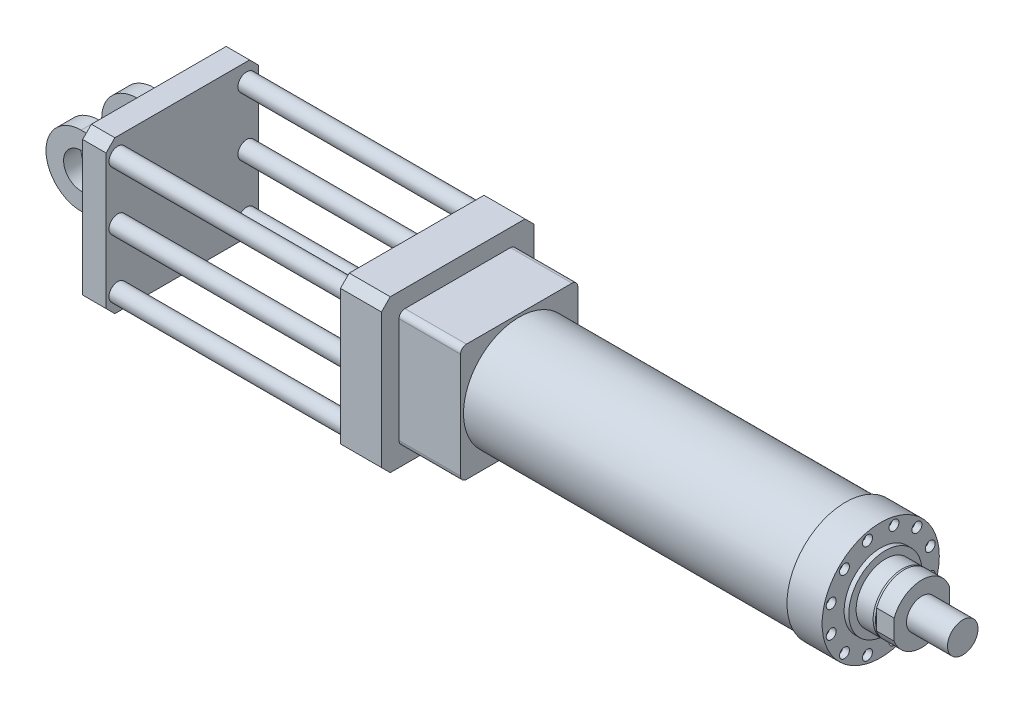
SolidWorks part; units mm, degrees
ref_plane "前视基准面" through (0, 0, 0) normal (0, 0, 1) x (1, 0, 0)
ref_plane "上视基准面" through (0, 0, 0) normal (0, 1, 0) x (1, 0, 0)
ref_plane "右视基准面" through (0, 0, 0) normal (1, 0, 0) x (0, 0, -1)
sketch "草图1" plane through (0, 0, 0) normal (1, 0, 0) x (0, 0, -1)
  circle A0 centre (0, 0) radius 80
  circle A1 centre (0, 0) radius 95
  dimension "D1" = 190
  dimension "D2" = 160
extrude "凸台-拉伸1" add sketch "草图1" along normal blind 557
sketch "草图2" plane through (557, 0, 0) normal (1, 0, 0) x (0, 0, -1)
  circle A0 centre (0, 0) radius 100
  dimension "D1" = 200
extrude "凸台-拉伸2" add sketch "草图2" along normal blind 60
sketch "草图3" plane through (617, 0, 0) normal (1, 0, 0) x (0, 0, -1)
  circle A0 centre (0, 0) radius 62.5
  dimension "D1" = 125
extrude "凸台-拉伸3" add sketch "草图3" along normal blind 8
sketch "草图4" plane through (617, 0, 0) normal (1, 0, 0) x (0, 0, -1)
  line L0 (0, 0) -> (0, 177.9426) construction
  line L1 (0, 0) -> (-182.6844, 0) construction
  line L2 (0, 0) -> (-40.3471, 150.5773) construction
  line L3 (0, 0) -> (-50.7607, 156.2254) construction
  circle A0 centre (0, 0) radius 87.5 construction
  circle A1 centre (-22.6467, 84.5185) radius 5.5
  circle A2 centre (-22.6467, 84.5185) radius 8.5
  circle A3 centre (0, 0) radius 112.5 construction
  circle A4 centre (-34.7644, 106.9939) radius 9
  circle A5 centre (34.7644, 106.9939) radius 9
  circle A6 centre (91.0144, 66.1258) radius 9
  circle A7 centre (112.5, 0) radius 9
  circle A8 centre (91.0144, -66.1258) radius 9
  circle A9 centre (34.7644, -106.9939) radius 9
  circle A10 centre (-34.7644, -106.9939) radius 9
  circle A11 centre (-91.0144, -66.1258) radius 9
  circle A12 centre (-112.5, 0) radius 9
  circle A13 centre (-91.0144, 66.1258) radius 9
  circle A14 centre (22.6467, 84.5185) radius 8.5
  circle A15 centre (22.6467, 84.5185) radius 5.5
  circle A16 centre (61.8718, 61.8718) radius 8.5
  circle A17 centre (61.8718, 61.8718) radius 5.5
  circle A18 centre (84.5185, 22.6467) radius 8.5
  circle A19 centre (84.5185, 22.6467) radius 5.5
  circle A20 centre (84.5185, -22.6467) radius 8.5
  circle A21 centre (84.5185, -22.6467) radius 5.5
  circle A22 centre (61.8718, -61.8718) radius 8.5
  circle A23 centre (61.8718, -61.8718) radius 5.5
  circle A24 centre (22.6467, -84.5185) radius 8.5
  circle A25 centre (22.6467, -84.5185) radius 5.5
  circle A26 centre (-22.6467, -84.5185) radius 8.5
  circle A27 centre (-22.6467, -84.5185) radius 5.5
  circle A28 centre (-61.8718, -61.8718) radius 8.5
  circle A29 centre (-61.8718, -61.8718) radius 5.5
  circle A30 centre (-84.5185, -22.6467) radius 8.5
  circle A31 centre (-84.5185, -22.6467) radius 5.5
  circle A32 centre (-84.5185, 22.6467) radius 8.5
  circle A33 centre (-84.5185, 22.6467) radius 5.5
  circle A34 centre (-61.8718, 61.8718) radius 8.5
  circle A35 centre (-61.8718, 61.8718) radius 5.5
  point P33 (0, 0)
  point P67 (0, 0)
  dimension "D1" = 175
  dimension "D3" = 11
  dimension "D4" = 17
  dimension "D5" = 225
  dimension "D7" = 18
  dimension "D2" = 15
  dimension "D6" = 18
  dimension "D8" = 10
  dimension "D9" = 12
extrude "切除-拉伸3" cut sketch "草图4" against normal blind 11 contours A2 | A34 | A32 | A30 | A28 | A26 | A24 | A22 | A20 | A18 | A16 | A14
sketch "草图6" plane through (625, 0, 0) normal (1, 0, 0) x (0, 0, -1)
  circle A0 centre (0, 0) radius 50
  dimension "D1" = 100
extrude "凸台-拉伸4" add sketch "草图6" along normal blind 32
chamfer "倒角1" distance 3 angle 20 1 edges at (657, 0, -50)
sketch "草图7" plane through (657, 0, 0) normal (1, 0, 0) x (0, 0, -1)
  line L2 (-47, 17.0587) -> (-47, -17.0587)
  line L4 (47, 17.0587) -> (47, -17.0587)
  line L5 (-30.7317, 39.4406) -> (30.7317, -39.4406) construction
  line L6 (-30.7317, -39.4406) -> (30.7317, 39.4406) construction
  arc A0 (-47, -17.0587) -> (47, -17.0587) centre (0, 0) ccw
  arc A1 (47, 17.0587) -> (-47, 17.0587) centre (0, 0) ccw
  dimension "D1" = 100
extrude "凸台-拉伸5" add sketch "草图7" along normal blind 30 contours A1 L2 A0 L4
sketch "草图8" plane through (687, 0, 0) normal (1, 0, 0) x (0, 0, -1)
  circle A0 centre (0, 0) radius 26
  dimension "D1" = 52
extrude "切除-拉伸4" cut sketch "草图8" against normal blind 82
sketch "草图9" plane through (0, 0, 0) normal (-1, 0, 0) x (0, 0, 1)
  line L1 (-90, 100) -> (90, 100)
  line L2 (-100, 90) -> (-100, -90)
  line L3 (-90, -100) -> (90, -100)
  line L4 (100, 90) -> (100, -90)
  line L5 (-100, 100) -> (100, -100) construction
  line L6 (-100, -100) -> (100, 100) construction
  arc A0 (100, -90) -> (90, -100) centre (90, -90) cw
  arc A1 (-90, -100) -> (-100, -90) centre (-90, -90) cw
  arc A2 (100, 90) -> (90, 100) centre (90, 90) ccw
  arc A3 (-100, 90) -> (-90, 100) centre (-90, 90) cw
  point P0 (0, 0)
  dimension "D3" = 10
  dimension "D1" = 200
  dimension "D2" = 200
extrude "凸台-拉伸6" add sketch "草图9" along normal blind 105
sketch "草图10" plane through (-105, 0, 0) normal (-1, 0, 0) x (0, 0, 1)
  line L5 (-130, 130) -> (130, 130)
  line L6 (-130, 130) -> (-130, -130)
  line L7 (-130, -130) -> (130, -130)
  line L8 (130, 130) -> (130, -130)
  line L9 (-130, 130) -> (130, -130) construction
  line L10 (-130, -130) -> (130, 130) construction
  point P0 (0, 0)
  dimension "D1" = 260
  dimension "D2" = 260
extrude "凸台-拉伸7" add sketch "草图10" along normal blind 70 separate body
sketch "草图11" plane through (-175, 0, 0) normal (-1, 0, 0) x (0, 0, 1)
  circle A0 centre (0, 0) radius 65
  dimension "D1" = 130
extrude "切除-拉伸5" cut sketch "草图11" against normal blind 30
sketch "草图12" plane through (-145, 0, 0) normal (-1, 0, 0) x (0, 0, 1)
  circle A0 centre (0, 0) radius 55
  dimension "D1" = 110
extrude "切除-拉伸6" cut sketch "草图12" against normal blind 31
sketch "草图13" plane through (-175, 0, 0) normal (-1, 0, 0) x (0, 0, 1)
  line L0 (0, 0) -> (0, 151.8431) construction
  line L1 (0, 0) -> (-171.834, 0) construction
  line L2 (0, 0) -> (-102.8659, 102.8659) construction
  circle A0 centre (0, 0) radius 82.5 construction
  circle A1 centre (-58.3363, 58.3363) radius 5
  circle A2 centre (58.3363, 58.3363) radius 5
  circle A3 centre (58.3363, -58.3363) radius 5
  circle A4 centre (-58.3363, -58.3363) radius 5
  circle A5 centre (0, 0) radius 87.5 construction
  circle A6 centre (0, 87.5) radius 5.5
  circle A7 centre (0, 87.5) radius 8.5
  circle A8 centre (43.75, 75.7772) radius 8.5
  circle A9 centre (43.75, 75.7772) radius 5.5
  circle A10 centre (75.7772, 43.75) radius 8.5
  circle A11 centre (75.7772, 43.75) radius 5.5
  circle A12 centre (87.5, 0) radius 8.5
  circle A13 centre (87.5, 0) radius 5.5
  circle A14 centre (75.7772, -43.75) radius 8.5
  circle A15 centre (75.7772, -43.75) radius 5.5
  circle A16 centre (43.75, -75.7772) radius 8.5
  circle A17 centre (43.75, -75.7772) radius 5.5
  circle A18 centre (0, -87.5) radius 8.5
  circle A19 centre (0, -87.5) radius 5.5
  circle A20 centre (-43.75, -75.7772) radius 8.5
  circle A21 centre (-43.75, -75.7772) radius 5.5
  circle A22 centre (-75.7772, -43.75) radius 8.5
  circle A23 centre (-75.7772, -43.75) radius 5.5
  circle A24 centre (-87.5, 0) radius 8.5
  circle A25 centre (-87.5, 0) radius 5.5
  circle A26 centre (-75.7772, 43.75) radius 8.5
  circle A27 centre (-75.7772, 43.75) radius 5.5
  circle A28 centre (-43.75, 75.7772) radius 8.5
  circle A29 centre (-43.75, 75.7772) radius 5.5
  point P17 (0, 0)
  point P54 (0, 0)
  dimension "D1" = 165
  dimension "D3" = 10
  dimension "D5" = 175
  dimension "D6" = 11
  dimension "D7" = 17
  dimension "D2" = 45
  dimension "D4" = 4
  dimension "D8" = 12
extrude "切除-拉伸7" cut sketch "草图13" against normal blind 20 contours A1 | A2 | A3 | A4
sketch "草图14" plane through (687, 0, 0) normal (1, 0, 0) x (0, 0, -1)
  circle A0 centre (0, 0) radius 26
  dimension "D1" = 52
extrude "凸台-拉伸8" add sketch "草图14" along normal blind 70
sketch "草图15" plane through (-175, 0, 0) normal (-1, 0, 0) x (0, 0, 1)
  line L0 (0, 0) -> (0, 47.4181) construction
  line L1 (-130, 130) -> (130, 130)
  line L2 (-130, 130) -> (-130, -130)
  line L3 (-130, -130) -> (130, -130)
  line L4 (130, 130) -> (130, -130)
  line L5 (-130, 130) -> (130, -130) construction
  line L6 (-130, -130) -> (130, 130) construction
  point P0 (0, 0)
  dimension "D1" = 260
  dimension "D2" = 260
extrude "凸台-拉伸9" add sketch "草图15" along normal blind 40 from offset 400 separate body
sketch "草图16" plane through (-175, 0, 0) normal (-1, 0, 0) x (0, 0, 1)
  line L0 (0, 0) -> (0, 27.0633) construction
  circle A0 centre (110, 100) radius 15
  circle A1 centre (110, -100) radius 15
  circle A2 centre (-110, 0) radius 15
  circle A3 centre (-110, -100) radius 15
  circle A4 centre (-110, 100) radius 15
  circle A5 centre (110, 0) radius 15
  dimension "D1" = 30
  dimension "D2" = 30
  dimension "D7" = 30
  dimension "D8" = 30
  dimension "D3" = 100
  dimension "D4" = 100
  dimension "D5" = 110
  dimension "D6" = 110
  dimension "D9" = 110
  dimension "D10" = 110
extrude "凸台-拉伸10" add sketch "草图16" along normal blind 400
sketch "草图17" plane through (-615, 0, 0) normal (-1, 0, 0) x (0, 0, 1)
  line L0 (-47.5, 0) -> (47.5, 0) construction
  line L2 (-62.5, 60) -> (-32.5, 60)
  line L3 (-62.5, 60) -> (-62.5, -60)
  line L4 (-62.5, -60) -> (-32.5, -60)
  line L5 (-32.5, 60) -> (-32.5, -60)
  line L6 (-62.5, 60) -> (-32.5, -60) construction
  line L7 (-62.5, -60) -> (-32.5, 60) construction
  line L8 (32.5, 60) -> (62.5, 60)
  line L9 (32.5, 60) -> (32.5, -60)
  line L10 (32.5, -60) -> (62.5, -60)
  line L11 (62.5, 60) -> (62.5, -60)
  line L12 (32.5, 60) -> (62.5, -60) construction
  line L13 (32.5, -60) -> (62.5, 60) construction
  point P4 (0, 0)
  dimension "D1" = 65
  dimension "D2" = 125
  dimension "D3" = 30
  dimension "D4" = 30
  dimension "D5" = 120
  dimension "D6" = 120
extrude "凸台-拉伸11" add sketch "草图17" along normal blind 130
sketch "草图18" plane through (0, 0, 62.5) normal (0, 0, 1) x (1, 0, 0)
  line L0 (-745, 0) -> (-685, 0) construction
  line L1 (-745, -60) -> (-745, 60) construction
  line L2 (-685, 60) -> (-850.9329, 82.0954)
  line L3 (-850.9329, 82.0954) -> (-803.8229, -103.1009)
  line L4 (-803.8229, -103.1009) -> (-685, -60)
  arc A0 (-685, 60) -> (-685, -60) centre (-685, 0) ccw
  circle A1 centre (-685, 0) radius 30
  dimension "D2" = 60
  dimension "D1" = 60
extrude "切除-拉伸8" cut sketch "草图18" against normal blind 130
chamfer "倒角2" distance 10 angle 45 8 edges at (-615, 60, -47.5) (-615, 0, -32.5) (-615, 0, -62.5) (-615, -60, -47.5) (-615, 0, 32.5) (-615, -60, 47.5) (-615, 0, 62.5) (-615, 60, 47.5)
chamfer "倒角3" distance 15 angle 45 4 edges at (-140, -130, 130) (-140, 130, 130) (-140, -130, -130) (-140, 130, -130)
chamfer "倒角4" distance 15 angle 45 4 edges at (-595, -130, -130) (-595, -130, 130) (-595, 130, -130) (-595, 130, 130)
